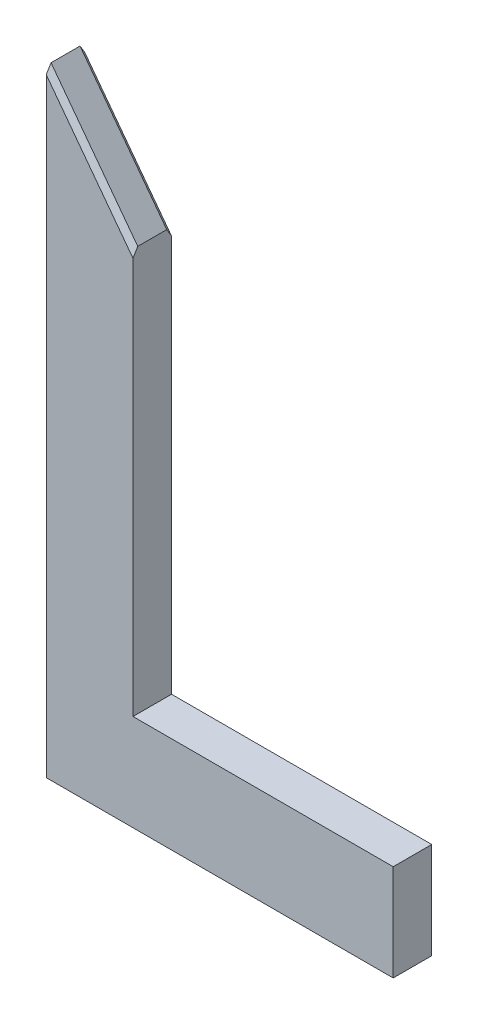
SolidWorks part; units mm, degrees
ref_plane "FRONT" through (0, 0, 0) normal (0, 0, 1) x (1, 0, 0)
ref_plane "TOP" through (0, 0, 0) normal (0, 1, 0) x (1, 0, 0)
ref_plane "RT-SIDE" through (0, 0, 0) normal (1, 0, 0) x (0, 0, -1)
sketch "Sketch1" plane through (0, 0, 0) normal (0, 0, 1) x (1, 0, 0)
  line L0 (0, 0) -> (152.4, 0)
  line L1 (0, 0) -> (0, 203.2)
  line L2 (0, 203.2) -> (152.4, 0)
  dimension "D1" = 152.4
  dimension "D2" = 203.2
extrude "Base-Extrude" add sketch "Sketch1" against normal blind 12.7
chamfer "Chamfer2" distance 1.5748 angle 45 2 edges at (76.2, 101.6, -12.7) (76.2, 101.6, 0)
sketch "Sketch3" plane through (0, 0, 0) normal (0, 0, 1) x (1, 0, 0)
  line L0 (114.3, 0) -> (114.3, 50.8)
  line L1 (0, 0) -> (150.4315, 0) construction
  line L2 (0, 203.2) -> (152.4, 0) construction
  line L3 (0, 200.5753) -> (0, 0) construction
  dimension "D1" = 114.3
extrude "Extrude1" cut sketch "Sketch3" against normal through all and the other way through all flip side to cut
sketch "Sketch4" plane through (0, 0, 0) normal (0, 0, 1) x (1, 0, 0)
  line L0 (114.3, 31.75) -> (28.575, 31.75)
  line L1 (114.3, 0) -> (114.3, 48.1753) construction
  line L2 (28.575, 184.15) -> (28.575, 31.75)
  line L3 (0, 0) -> (114.3, 0) construction
  line L4 (0, 200.5753) -> (0, 0) construction
  line L5 (28.575, 184.15) -> (142.875, 31.75)
  line L6 (142.875, 31.75) -> (114.3, 31.75)
  line L7 (0, 203.2) -> (114.3, 50.8) construction
  dimension "D1" = 31.75
  dimension "D2" = 28.575
  dimension "D3" = 28.575
extrude "Cut-Extrude1" cut sketch "Sketch4" against normal through all contours L5 L6 L0 L2
